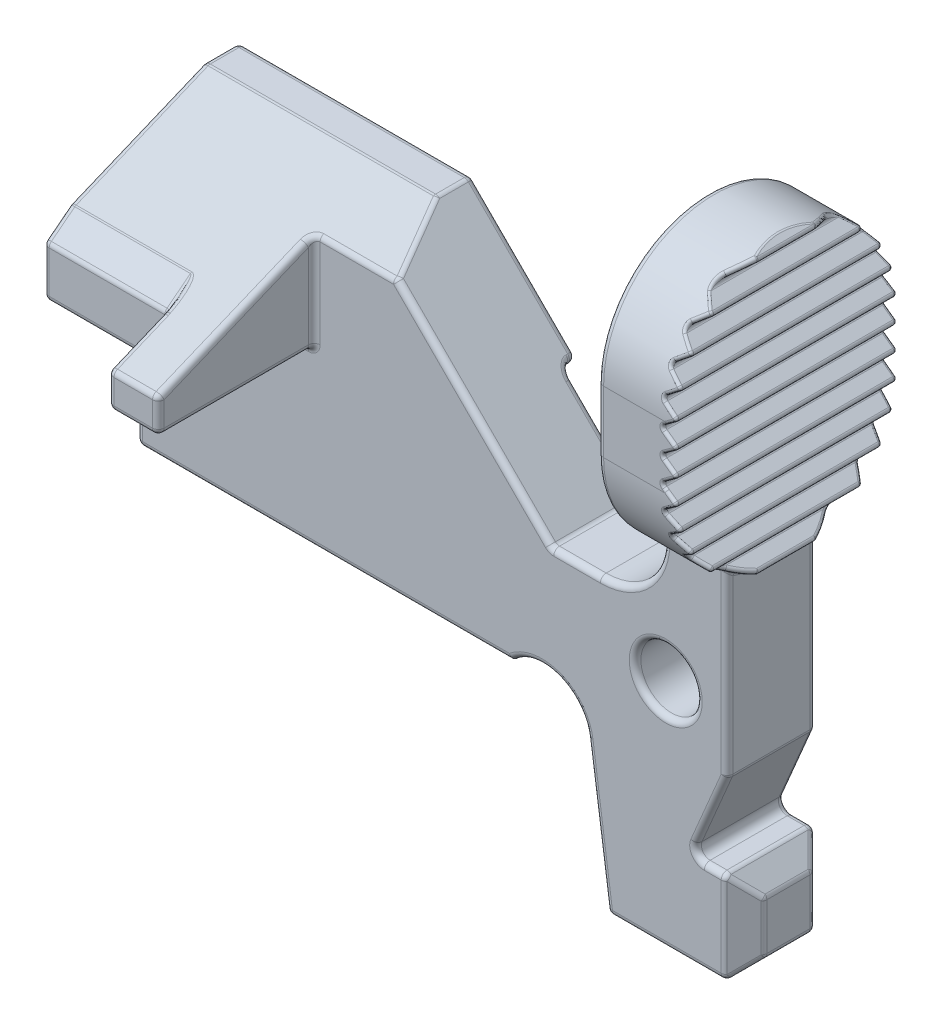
SolidWorks part; units mm, degrees
ref_plane "front" through (0, 0, 0) normal (0, 0, 1) x (1, 0, 0)
ref_plane "top" through (0, 0, 0) normal (0, 1, 0) x (1, 0, 0)
ref_plane "side" through (0, 0, 0) normal (1, 0, 0) x (0, 0, -1)
sketch "Sketch1" plane through (0, 0, 0) normal (0, 0, 1) x (1, 0, 0)
  line L0 (24.3078, -3.048) -> (24.3078, -5.5049) construction
  line L1 (0, -50) -> (0, 50) construction
  line L2 (0, 13.0048) -> (10.16, 13.0048)
  line L3 (10.16, 13.0048) -> (18.034, 5.1308)
  line L4 (18.034, 5.1308) -> (20.1676, 5.1308)
  line L5 (22.9362, 7.8994) -> (22.9362, 20.066)
  line L6 (22.9362, 20.066) -> (26.416, 20.066)
  line L7 (26.416, 20.066) -> (26.416, 7.747)
  line L8 (25.6794, 7.747) -> (25.6794, 0.2608)
  line L10 (0, 0) -> (16.3042, 0)
  line L12 (-4.1174, 8.128) -> (14.0423, 8.128) construction
  line L13 (20.4724, -7.4422) -> (26.416, -7.4422)
  line L14 (-4.1174, -7.4422) -> (14.0423, -7.4422) construction
  line L15 (25.6794, 7.747) -> (26.416, 7.747)
  line L16 (25.6794, 0.2608) -> (24.3381, -2.8991)
  line L17 (24.6888, -3.429) -> (26.416, -3.429)
  line L18 (26.416, -3.429) -> (26.416, -7.4422)
  line L19 (0, 13.0048) -> (0, 0)
  line L22 (19.5951, -1.2002) -> (20.4724, -7.4422)
  arc A0 (19.5951, -1.2002) -> (16.3042, 0) centre (17.6301, -1.4764) ccw
  arc A1 (20.1676, 5.1308) -> (22.9362, 7.8994) centre (20.1676, 7.8994) ccw
  arc A2 (24.3381, -2.8991) -> (24.6888, -3.429) centre (24.6888, -3.048) ccw
  circle A3 centre (23.0124, 2.6162) radius 1.3335
  dimension "D15" = 3.9688
  dimension "D20" = 5.5372
  dimension "D14" = 0.381
  dimension "D21" = 10.0584
  dimension "D25" = 2.667
  dimension "D3" = 26.416
  dimension "D4" = 22.9362
  dimension "D5" = 45
  dimension "D6" = 23
  dimension "D7" = 7.874
  dimension "D8" = 4.8768
  dimension "D10" = 11.938
  dimension "D11" = 12.319
  dimension "D12" = 4.0132
  dimension "D13" = 25.6794
  dimension "D17" = 2.1082
  dimension "D18" = 8
  dimension "D16" = 7.6454
  dimension "D22" = 13.0048
  dimension "D23" = 26.416
  dimension "D24" = 2.667
  dimension "D26" = 5.9436
  dimension "D27" = 7.9502
  dimension "D9" = 15.5702
extrude "Boss-Extrude1" add sketch "Sketch1" along normal blind 3.8608
sketch "Sketch2" plane through (26.416, 0, 0) normal (1, 0, 0) x (0, 0, -1)
  line L0 (-1.9304, 15.2527) -> (-1.9304, 12.5603) construction
  line L1 (2.8829, 15.2527) -> (2.8829, 12.5603)
  line L2 (-6.7437, 15.2527) -> (-6.7437, 12.5603)
  line L3 (-3.8608, 20.066) -> (0, 20.066) construction
  line L4 (-1.9304, 20.066) -> (-1.9304, 28.9923) construction
  line L5 (-3.8608, 7.747) -> (0, 7.747) construction
  arc A0 (2.8829, 15.2527) -> (-6.7437, 15.2527) centre (-1.9304, 15.2527) ccw
  arc A1 (-6.7437, 12.5603) -> (2.8829, 12.5603) centre (-1.9304, 12.5603) ccw
  point P2 (-1.9304, 13.9065)
  point P11 (0, 0)
  dimension "D1" = 9.6266
extrude "Boss-Extrude2" add sketch "Sketch2" against normal up to surface (3.4798 mm away)
sketch "Sketch3" plane through (26.416, 0, 0) normal (1, 0, 0) x (0, 0, -1)
  line L2 (2.8829, 12.5603) -> (2.8829, 15.2527)
  line L3 (-6.7437, 15.2527) -> (-6.7437, 12.5603)
  line L12 (-3.8608, 7.747) -> (0, 7.747)
  line L13 (0, 7.747) -> (0, 8.1511)
  line L14 (2.8829, 12.5603) -> (2.8829, 15.2527)
  line L15 (0, 19.6619) -> (0, 20.066)
  line L16 (0, 20.066) -> (-3.8608, 20.066)
  line L17 (-3.8608, 20.066) -> (-3.8608, 19.6619)
  line L18 (-6.7437, 15.2527) -> (-6.7437, 12.5603)
  line L19 (-3.8608, 8.1511) -> (-3.8608, 7.747)
  line L20 (-3.8608, 7.747) -> (0, 7.747)
  line L21 (0, 7.747) -> (0, 8.1511)
  line L23 (0, 19.6619) -> (0, 20.066)
  line L24 (0, 20.066) -> (-3.8608, 20.066)
  line L25 (-3.8608, 20.066) -> (-3.8608, 19.6619)
  line L27 (-3.8608, 8.1511) -> (-3.8608, 7.747)
  arc A2 (-6.7437, 12.5603) -> (2.8829, 12.5603) centre (-1.9304, 12.5603) ccw
  arc A3 (2.8829, 15.2527) -> (-6.7437, 15.2527) centre (-1.9304, 15.2527) ccw
  arc A4 (-3.8608, 8.1511) -> (0, 8.1511) centre (-1.9304, 12.5603) ccw
  arc A5 (0, 19.6619) -> (-3.8608, 19.6619) centre (-1.9304, 15.2527) ccw
  arc A8 (0, 8.1511) -> (2.8829, 12.5603) centre (-1.9304, 12.5603) ccw
  arc A9 (2.8829, 15.2527) -> (0, 19.6619) centre (-1.9304, 15.2527) ccw
  arc A10 (-3.8608, 19.6619) -> (-6.7437, 15.2527) centre (-1.9304, 15.2527) ccw
  arc A11 (-6.7437, 12.5603) -> (-3.8608, 8.1511) centre (-1.9304, 12.5603) ccw
  dimension "D1" = 0
  dimension "D2" = 0
extrude "Cut-Extrude1" cut sketch "Sketch3" against normal up to surface (0.7366 mm away) contours A5 M22 M23 | A5 L24 M24 | A4 L20 M18 | A4 M28 M17
sketch "Sketch4" plane through (25.6794, 0, 0) normal (1, 0, 0) x (0, 0, -1)
  line L0 (0, 19.6619) -> (0, 20.066) construction
  line L1 (0, 20.066) -> (-1.9304, 20.066) construction
  line L2 (-1.9304, 20.066) -> (-3.8608, 20.066) construction
  line L3 (-3.8608, 20.066) -> (-3.8608, 19.6619) construction
  line L4 (0, 19.6619) -> (0, 20.066)
  line L5 (0, 20.066) -> (-1.9304, 20.066)
  line L6 (-1.9304, 20.066) -> (-3.8608, 20.066)
  line L7 (-3.8608, 20.066) -> (-3.8608, 19.6619)
  arc A0 (0, 19.6619) -> (-1.9304, 20.066) centre (-1.9304, 15.2527) ccw construction
  arc A1 (-1.9304, 20.066) -> (-3.8608, 19.6619) centre (-1.9304, 15.2527) ccw construction
  arc A2 (0, 19.6619) -> (-1.9304, 20.066) centre (-1.9304, 15.2527) ccw
  arc A3 (-1.9304, 20.066) -> (-3.8608, 19.6619) centre (-1.9304, 15.2527) ccw
extrude "Cut-Extrude2" cut sketch "Sketch4" against normal blind 3.8608 contours A2 L4 L5 | L6 L7 A3
sketch "Sketch5" plane through (0, 0, -2.8829) normal (0, 0, -1) x (-1, 0, 0)
  line L0 (-26.416, 13.9065) -> (-30.9589, 13.9065) construction
  line L1 (-26.416, 12.5603) -> (-26.416, 15.2527) construction
  line L2 (-26.416, 14.9733) -> (-30.9589, 14.9733) construction
  line L3 (-26.416, 16.0401) -> (-30.9589, 16.0401) construction
  line L4 (-26.416, 17.1069) -> (-30.9589, 17.1069) construction
  line L5 (-26.416, 18.1737) -> (-30.9589, 18.1737) construction
  line L6 (-26.416, 19.2405) -> (-30.9589, 19.2405) construction
  line L7 (-25.6794, 4.2059) -> (-25.6794, 22.635) construction
  line L8 (-25.6794, 0.2608) -> (-25.6794, 8.1511) construction
  line L9 (-25.8447, 20.5613) -> (-28.2077, 20.5613)
  line L10 (-25.6794, 13.9065) -> (-26.416, 14.4399)
  line L11 (-26.416, 14.4399) -> (-27.6127, 14.4399) construction
  line L12 (-25.6794, 14.9733) -> (-26.416, 14.4399)
  line L13 (-25.6794, 16.0401) -> (-26.416, 15.5067)
  line L14 (-25.6794, 14.9733) -> (-26.416, 15.5067)
  line L15 (-25.6794, 17.1069) -> (-26.416, 16.5735)
  line L16 (-25.6794, 16.0401) -> (-26.416, 16.5735)
  line L17 (-25.6794, 18.1737) -> (-26.416, 17.6403)
  line L18 (-25.6794, 17.1069) -> (-26.416, 17.6403)
  line L19 (-25.6794, 19.2405) -> (-26.416, 18.7071)
  line L20 (-25.6794, 18.1737) -> (-26.416, 18.7071)
  line L21 (-25.8447, 20.1876) -> (-26.416, 19.7739)
  line L22 (-25.6794, 19.2405) -> (-26.416, 19.7739)
  line L23 (-25.6794, 8.5725) -> (-26.416, 8.0391)
  line L24 (-25.8447, 7.6254) -> (-26.416, 8.0391)
  line L25 (-25.6794, 9.6393) -> (-26.416, 9.1059)
  line L26 (-25.6794, 8.5725) -> (-26.416, 9.1059)
  line L27 (-25.6794, 10.7061) -> (-26.416, 10.1727)
  line L28 (-25.6794, 9.6393) -> (-26.416, 10.1727)
  line L29 (-25.6794, 11.7729) -> (-26.416, 11.2395)
  line L30 (-25.6794, 10.7061) -> (-26.416, 11.2395)
  line L31 (-25.6794, 12.8397) -> (-26.416, 12.3063)
  line L32 (-25.6794, 11.7729) -> (-26.416, 12.3063)
  line L33 (-25.6794, 12.8397) -> (-26.416, 13.3731)
  line L34 (-25.6794, 13.9065) -> (-26.416, 13.3731)
  line L35 (-28.2077, 20.5613) -> (-28.2077, 7.2517)
  line L36 (-28.2077, 7.2517) -> (-25.8447, 7.2517)
  line L37 (-26.416, 14.9733) -> (-26.416, 13.9065) construction
  line L38 (-25.8447, 7.6254) -> (-25.8447, 7.2517)
  line L39 (-25.8447, 20.5613) -> (-25.8447, 20.1876)
  dimension "D1" = 6
  dimension "D2" = 6
extrude "Cut-Extrude3" cut sketch "Sketch5" against normal blind 14.0208
chamfer "Chamfer1" distance 0.889 angle 45 4 edges at (26.416, -5.4356, 3.8608) (26.416, -7.4422, 1.9304) (26.416, -5.4356, 0) (26.416, -3.429, 1.9304)
sketch "Sketch6" plane through (0, 0, 0) normal (-1, 0, 0) x (0, 0, 1)
  line L1 (0, 8.1788) -> (-0.5842, 8.1788)
  line L2 (-0.5842, 13.0048) -> (-0.5842, 0)
  line L3 (-0.5842, 13.0048) -> (-0.5842, 8.1788)
  line L4 (0, 13.0048) -> (0, 0) construction
  line L5 (-0.5842, 13.0048) -> (0, 13.0048)
  line L6 (0, 13.0048) -> (0, 8.1788)
  line L7 (3.8608, 13.0048) -> (0, 13.0048) construction
  dimension "D2" = 4.826
  dimension "D1" = 0.5842
extrude "Boss-Extrude3" add sketch "Sketch6" against normal up to surface (10.16 mm away)
sketch "Sketch7" plane through (0, 0, 0) normal (-1, 0, 0) x (0, 0, 1)
  line L0 (0.9652, 13.0048) -> (12.7221, 8.1349)
  line L1 (3.8608, 13.0048) -> (-0.5842, 13.0048) construction
  line L2 (12.7221, 8.1349) -> (12.7221, 13.0048)
  line L3 (12.7221, 13.0048) -> (0.9652, 13.0048)
  line L4 (-0.5842, 13.0048) -> (-0.5842, 8.1788) construction
  dimension "D1" = 1.5494
  dimension "D2" = 22.5
extrude "Cut-Extrude4" cut sketch "Sketch7" against normal up to surface (15.0299 mm away)
sketch "Sketch8" plane through (0, 0, 0) normal (-1, 0, 0) x (0, 0, 1)
  line L0 (3.8608, 11.8054) -> (3.8608, 0) construction
  line L1 (0.9652, 13.0048) -> (3.8608, 11.8054) construction
  line L3 (3.8608, 11.8054) -> (3.8608, 7.5057)
  line L4 (3.8608, 11.8054) -> (10.6426, 8.9963)
  line L6 (10.6426, 8.9963) -> (10.6426, 7.5057)
  line L7 (-0.5842, 13.0048) -> (-0.5842, 8.1788) construction
  line L9 (3.8608, 0) -> (0, 0) construction
  line L10 (3.8608, 7.5057) -> (10.6426, 7.5057)
  dimension "D1" = 11.2268
  dimension "D2" = 7.5057
extrude "Boss-Extrude4" add sketch "Sketch8" against normal blind 7.7216
sketch "Sketch9" plane through (0, 0, 0) normal (-1, 0, 0) x (0, 0, 1)
  line L0 (-0.5842, 13.0048) -> (-0.5842, 8.1788) construction
  line L1 (12.7631, 10.6343) -> (7.9248, 10.6343)
  line L2 (12.7631, 10.6343) -> (12.7631, 4.3375)
  line L3 (12.7631, 4.3375) -> (7.9248, 4.3375)
  line L4 (7.9248, 10.6343) -> (7.9248, 4.3375)
  dimension "D1" = 8.509
extrude "Cut-Extrude5" cut sketch "Sketch9" against normal offset from surface (5.5372 mm away) 2.1844
sketch "Sketch10" plane through (0, 0, 0) normal (-1, 0, 0) x (0, 0, 1)
  line L0 (6.7818, 10.5955) -> (7.9248, 9.7025)
  line L1 (0.9652, 13.0048) -> (7.9248, 10.122) construction
  line L2 (-0.5842, 13.0048) -> (-0.5842, 8.1788) construction
  line L3 (7.9248, 10.122) -> (7.9248, 7.5057) construction
  line L4 (7.9248, 10.122) -> (7.9248, 7.5057) construction
  line L5 (6.7818, 10.5955) -> (7.9248, 10.122)
  line L6 (7.9248, 10.122) -> (7.9248, 9.7025)
  dimension "D1" = 52
  dimension "D2" = 1.143
extrude "Cut-Extrude6" cut sketch "Sketch10" against normal up to surface (5.5372 mm away)
fillet "Fillet1" radius 0.254 7 edges at (2.7686, 7.5057, 7.9248) (2.7686, 10.5955, 6.7818) (5.5372, 8.251, 10.6426) (5.5372, 7.5057, 9.2837) (5.5372, 8.6041, 7.9248) (5.5372, 10.149, 7.3533) (5.5372, 9.7959, 8.7122)
fillet "Fillet2" radius 0.254 6 edges at (9.5405, 11.8054, 3.8608) (3.8608, 7.5057, 3.8608) (7.7216, 9.6556, 3.8608) (7.7216, 7.5057, 7.2517) (7.7216, 8.251, 10.6426) (7.7216, 10.4008, 7.2517)
fillet "Fillet3" radius 0.254 82 edges at (18.31, 0.3879, 3.8608) (25.6794, 7.747, 1.9304) (20.0338, -4.3212, 3.8608) (22.9997, -7.4422, 3.8608) (16.51, 6.6548, 0) (19.1008, 5.1308, 0) (22.1253, 5.9417, 0) (25.6794, 4.2059, 0) (25.0087, -1.3192, 0) (24.3711, -3.2583, 0) (22.9997, -7.4422, 0) (20.0338, -4.3212, 0) (18.31, 0.3879, 0) (8.1521, 0, 0) (24.3711, -3.2583, 3.8608) (25.0087, -1.3192, 3.8608) (18.034, 5.1308, 1.9304) (25.6794, 0.2608, 1.9304) (20.4724, -7.4422, 1.9304) (0, 0, 1.9304) (25.6794, 4.2059, 3.8608) (24.3459, 2.6162, 0) (24.3459, 2.6162, 3.8608) (22.1253, 5.9417, 3.8608) (25.1079, -3.429, 3.8608) (25.527, -5.4356, 3.8608) (26.416, -4.318, 1.9304) (26.416, -5.4356, 0.889) (26.416, -6.5532, 1.9304) (26.416, -5.4356, 2.9718) (25.527, -7.4422, 1.9304) (25.1079, -3.429, 0) (25.527, -5.4356, 0) (25.527, -3.429, 1.9304) (25.9715, -6.9977, 0.4445) (25.9715, -3.8735, 0.4445) (25.9715, -6.9977, 3.4163) (25.9715, -3.8735, 3.4163) (19.1008, 5.1308, 3.8608) (0, 4.0894, 0) (7.493, 8.1788, 0) (7.493, 8.1788, -0.5842) (5.08, 13.0048, -0.5842) (0, 10.5918, -0.5842) (0, 8.1788, -0.2921) (14.986, 8.1788, -0.2921) (12.573, 10.5918, -0.5842) (10.16, 13.0048, 0.1905) (0, 13.0048, 0.1905) (5.08, 13.0048, 0.9652) (0, 11.8068, 3.8575) (14.7816, 8.3832, 3.8608) (22.9362, 8.0252, 0) (22.9362, 8.0252, 3.8608) (0, 8.7311, 7.9248) (2.6416, 9.7025, 7.9248) (0, 10.1383, 7.3669) (0, 10.5935, 6.7806) (0, 7.5801, 7.8504) (5.4463, 10.3576, 7.1827) (5.5311, 9.8001, 8.1226) (5.6143, 9.9484, 8.1758) (5.6116, 8.9466, 10.5682) (5.4385, 9.7283, 7.9778) (5.6116, 7.5801, 10.5682) (6.6294, 8.9963, 10.6426) (10.7272, 12.4376, 2.3346) (11.388, 11.7768, 3.818) (0, 3.6259, 3.8608) (0, 7.5057, 5.8928) (6.6294, 7.5057, 10.6426) (0, 7.4313, 3.9352) (7.6472, 7.5801, 10.5682) (7.6472, 8.9466, 10.5682) (24.3078, 8.1511, 0) (22.9362, 9.9263, -2.0982) (22.9362, 20.066, 1.9304) (22.9362, 13.9065, -2.8829) (22.9362, 9.9263, 5.959) (22.9362, 13.9065, 6.7437) (24.3078, 8.1511, 3.8608) (8.1521, 0, 3.8608)
fillet "Fillet4" radius 0.127 23 edges at (25.6794, 8.5725, 1.9304) (25.6794, 9.6393, 1.9304) (25.6794, 10.7061, 1.9304) (25.6794, 11.7729, 1.9304) (25.6794, 12.8397, 1.9304) (25.6794, 13.9065, 1.9304) (25.6794, 14.9733, 1.9304) (25.6794, 16.0401, 1.9304) (25.6794, 17.1069, 1.9304) (25.6794, 18.1737, 1.9304) (25.6794, 19.2405, 1.9304) (26.416, 19.7739, 1.9304) (26.416, 18.7071, 1.9304) (26.416, 17.6403, 1.9304) (26.416, 16.5735, 1.9304) (26.416, 15.5067, 1.9304) (26.416, 14.4399, 1.9304) (26.416, 13.3731, 1.9304) (26.416, 12.3063, 1.9304) (26.416, 11.2395, 1.9304) (26.416, 10.1727, 1.9304) (26.416, 8.0391, 1.9304) (26.416, 9.1059, 1.9304)
fillet "Fillet5" radius 0.127 96 edges at (26.3094, 8.1028, 0.1143) (26.322, 8.0055, 3.4867) (26.0126, 7.747, 1.9304) (26.0636, 8.2943, -0.2987) (26.0636, 8.2943, 4.1595) (25.7694, 8.5839, -0.7818) (25.769, 8.5767, 4.6321) (26.0403, 8.8338, 4.9769) (26.0403, 8.8338, -1.1161) (26.3259, 9.1176, -1.4335) (26.326, 9.0949, 5.2709) (26.0523, 9.3693, -1.6731) (26.0523, 9.3693, 5.5339) (25.7732, 9.672, -1.92) (25.7727, 9.6087, 5.7325) (26.0446, 9.9038, 5.9442) (26.0446, 9.9038, -2.0834) (26.3259, 10.1609, -2.2422) (26.3256, 10.1874, 6.1182) (26.0498, 10.4379, -2.3897) (26.0498, 10.4379, 6.2505) (25.7693, 10.696, -2.5072) (25.7695, 10.7182, 6.3772) (26.0463, 10.9718, 6.474) (26.0463, 10.9718, -2.6132) (26.3261, 11.2303, -2.6955) (26.326, 11.2499, 6.5619) (26.0486, 11.5056, -2.7659) (26.0486, 11.5056, 6.6267) (25.7692, 11.7642, -2.8166) (25.7693, 11.7823, 6.6804) (26.0473, 12.0393, 6.7154) (26.0473, 12.0393, -2.8546) (26.3262, 12.2977, -2.8757) (26.3262, 12.3151, 6.7374) (26.1696, 12.4847, 6.7431) (25.9433, 12.6486, 6.7437) (25.7689, 12.8397, 6.7437) (26.0477, 13.1064, 6.7437) (26.3265, 13.3731, 6.7437) (26.0477, 13.6398, 6.7437) (25.7689, 13.9065, 6.7437) (26.0477, 14.1732, 6.7437) (26.3265, 14.4399, 6.7437) (26.0477, 14.7066, 6.7437) (25.7689, 14.9733, 6.7437) (25.9433, 15.1644, 6.7437) (26.1696, 15.3283, 6.7431) (26.3262, 15.4979, -2.8766) (26.3262, 15.5153, 6.7365) (26.0473, 15.7737, -2.8546) (26.0473, 15.7737, 6.7154) (25.7693, 16.0307, -2.8196) (25.7692, 16.0488, 6.6774) (26.0486, 16.3074, 6.6267) (26.0486, 16.3074, -2.7659) (26.326, 16.5631, -2.7011) (26.3261, 16.5827, 6.5563) (26.0463, 16.8412, -2.6132) (26.0463, 16.8412, 6.474) (25.7695, 17.0948, -2.5164) (25.7693, 17.117, 6.368) (26.0498, 17.3751, 6.2505) (26.0498, 17.3751, -2.3897) (26.3256, 17.6256, -2.2574) (26.3259, 17.6521, 6.103) (26.0446, 17.9092, -2.0834) (26.0446, 17.9092, 5.9442) (25.7727, 18.2043, -1.8717) (25.7732, 18.141, 5.7808) (26.0523, 18.4437, 5.5339) (26.0523, 18.4437, -1.6731) (26.326, 18.7181, -1.4101) (26.3259, 18.6954, 5.2943) (26.0403, 18.9792, -1.1161) (26.0403, 18.9792, 4.9769) (25.769, 19.2363, -0.7713) (25.7694, 19.2291, 4.6426) (26.0636, 19.5187, 4.1595) (26.0636, 19.5187, -0.2987) (26.322, 19.8075, 0.3741) (26.3094, 19.7102, 3.7465) (26.0126, 20.066, 1.9304) (26.1696, 15.3283, -2.8823) (25.9433, 15.1644, -2.8829) (25.7689, 14.9733, -2.8829) (26.0477, 14.7066, -2.8829) (26.3265, 14.4399, -2.8829) (26.0477, 14.1732, -2.8829) (25.7689, 13.9065, -2.8829) (26.0477, 13.6398, -2.8829) (26.3265, 13.3731, -2.8829) (26.0477, 13.1064, -2.8829) (25.7689, 12.8397, -2.8829) (25.9433, 12.6486, -2.8829) (26.1696, 12.4847, -2.8823)
